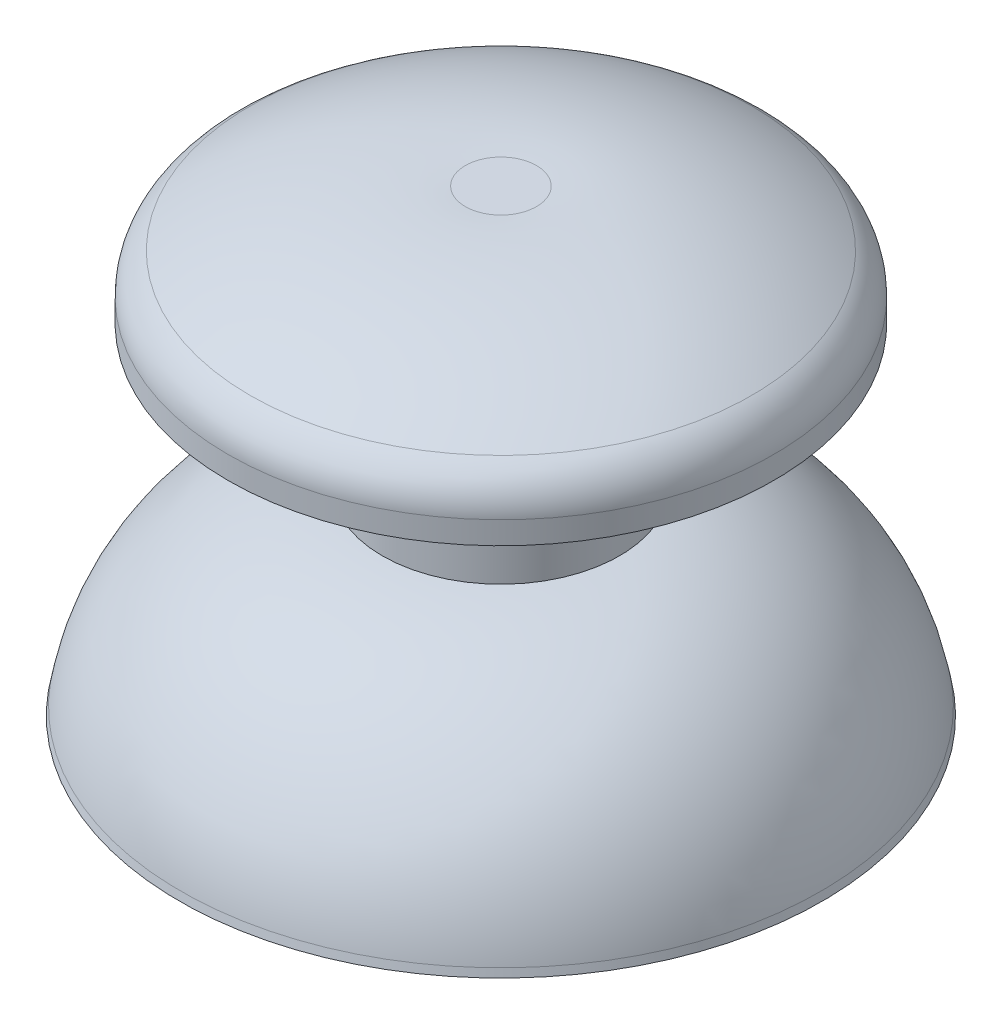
SolidWorks part; units mm, degrees
ref_plane "Plan de face" through (0, 0, 0) normal (0, 0, 1) x (1, 0, 0)
ref_plane "Plan de dessus" through (0, 0, 0) normal (0, 1, 0) x (1, 0, 0)
ref_plane "Plan de droite" through (0, 0, 0) normal (1, 0, 0) x (0, 0, -1)
sketch "Esquisse1" plane through (0, 0, 0) normal (0, 0, 1) x (1, 0, 0)
  line L0 (0, 0) -> (0, 82.8707) construction
  line L1 (0, 53.4298) -> (1.61, 53.4298)
  line L2 (1.61, 53.4298) -> (1.61, 48.5098)
  line L3 (1.61, 48.5098) -> (8.82, 48.5098)
  line L4 (0, 62.5998) -> (0, 53.4298)
  line L5 (0, 62.5998) -> (1.5, 62.5998)
  line L6 (11.5, 58.5498) -> (11.5, 57.5998)
  line L7 (11.5, 57.5998) -> (5, 57.5998)
  line L8 (5, 57.5998) -> (5, 51.5998)
  line L9 (13.4859, 43.5998) -> (13.55, 43.2698)
  line L10 (12.04, 43.2698) -> (13.55, 43.2698)
  line L11 (11.9759, 43.5998) -> (12.04, 43.2698)
  line L12 (13.55, 43.2698) -> (13.5476, 43.2681)
  line L13 (10.57, 68.4734) -> (10.57, 60.2398) construction
  line L14 (6.5422, 60.2398) -> (13.4859, 60.2398) construction
  arc A0 (8.82, 48.5098) -> (11.9759, 43.5998) centre (3.8617, 41.8536) cw
  arc A1 (5, 51.5998) -> (13.4859, 43.5998) centre (3.8401, 41.8687) cw
  arc A2 (10.57, 60.2398) -> (11.5, 58.5498) centre (9.5, 58.5501) cw
  arc A3 (1.5, 62.5998) -> (10.57, 60.2398) centre (2.3092, 47.1009) cw
  dimension "D12" = 8.3
  dimension "D13" = 9.8
  dimension "D18" = 2
  dimension "D19" = 15.52
  dimension "D1" = 9.17
  dimension "D2" = 1.61
  dimension "D3" = 4.92
  dimension "D4" = 7.21
  dimension "D5" = 1.5
  dimension "D7" = 5
  dimension "D8" = 6.5
  dimension "D9" = 6
  dimension "D11" = 1.51
  dimension "D14" = 2.64
  dimension "D15" = 1.51
  dimension "D16" = 0.95
  dimension "D17" = 11.94
revolve "Révolution3" add sketch "Esquisse1" angle 360 about L0
